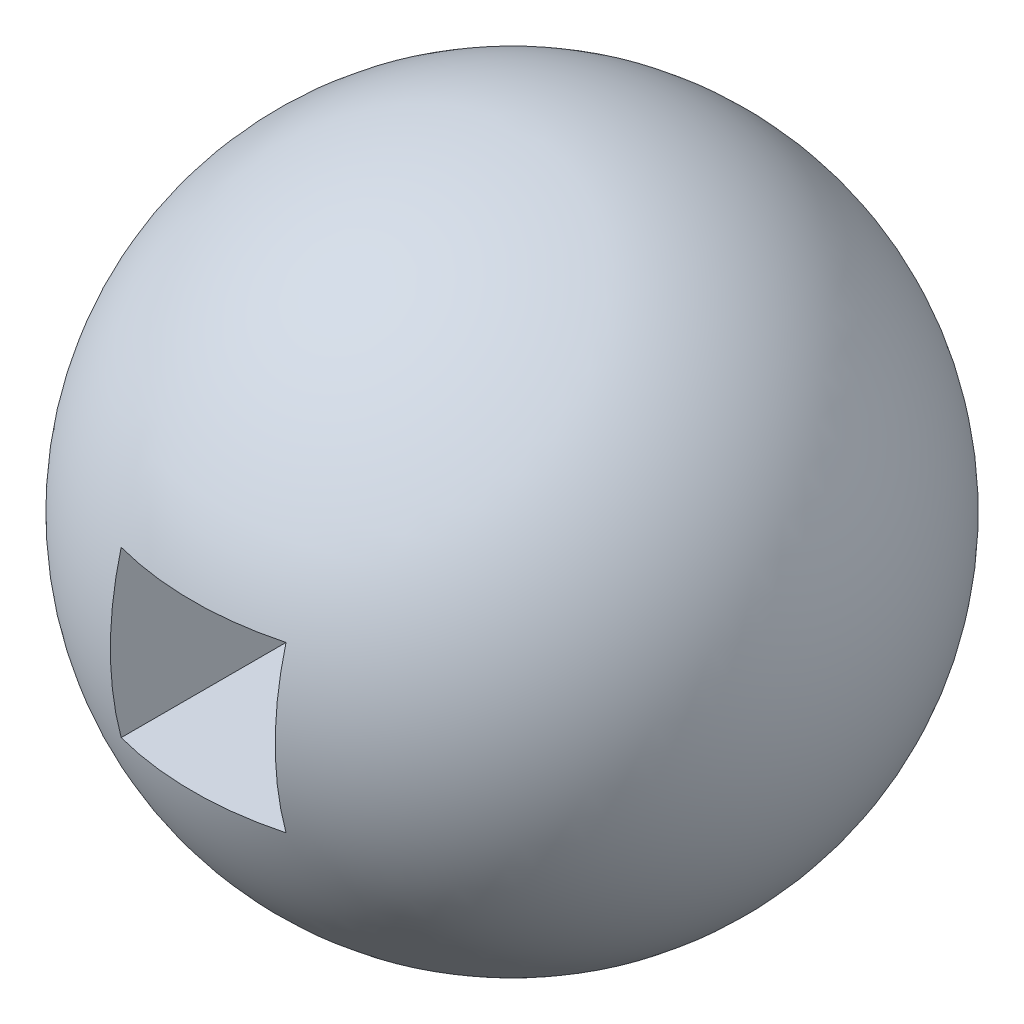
SolidWorks part; units mm, degrees
ref_plane "Front Plane" through (0, 0, 0) normal (0, 0, 1) x (1, 0, 0)
ref_plane "Top Plane" through (0, 0, 0) normal (0, 1, 0) x (1, 0, 0)
ref_plane "Right Plane" through (0, 0, 0) normal (1, 0, 0) x (0, 0, -1)
sketch "Sketch1" plane through (0, 0, 0) normal (0, 0, 1) x (1, 0, 0)
  line L0 (0, 2) -> (0, -2)
  arc A0 (0, 2) -> (0, -2) centre (0, 0) ccw
  dimension "D1" = 2
revolve "Revolve1" add sketch "Sketch1" angle 360 about L0
sketch "Sketch2" plane through (0, 0, 0) normal (0, 0, 1) x (1, 0, 0)
  line L1 (-0.5, -0.5) -> (0.5, -0.5)
  line L2 (-0.5, -0.5) -> (-0.5, 0.5)
  line L3 (-0.5, 0.5) -> (0.5, 0.5)
  line L4 (0.5, -0.5) -> (0.5, 0.5)
  line L5 (-0.5, -0.5) -> (0.5, 0.5) construction
  line L6 (-0.5, 0.5) -> (0.5, -0.5) construction
  point P0 (0, 0)
  dimension "D1" = 1
extrude "Cut-Extrude1" cut sketch "Sketch2" against normal up to surface and the other way up to surface
